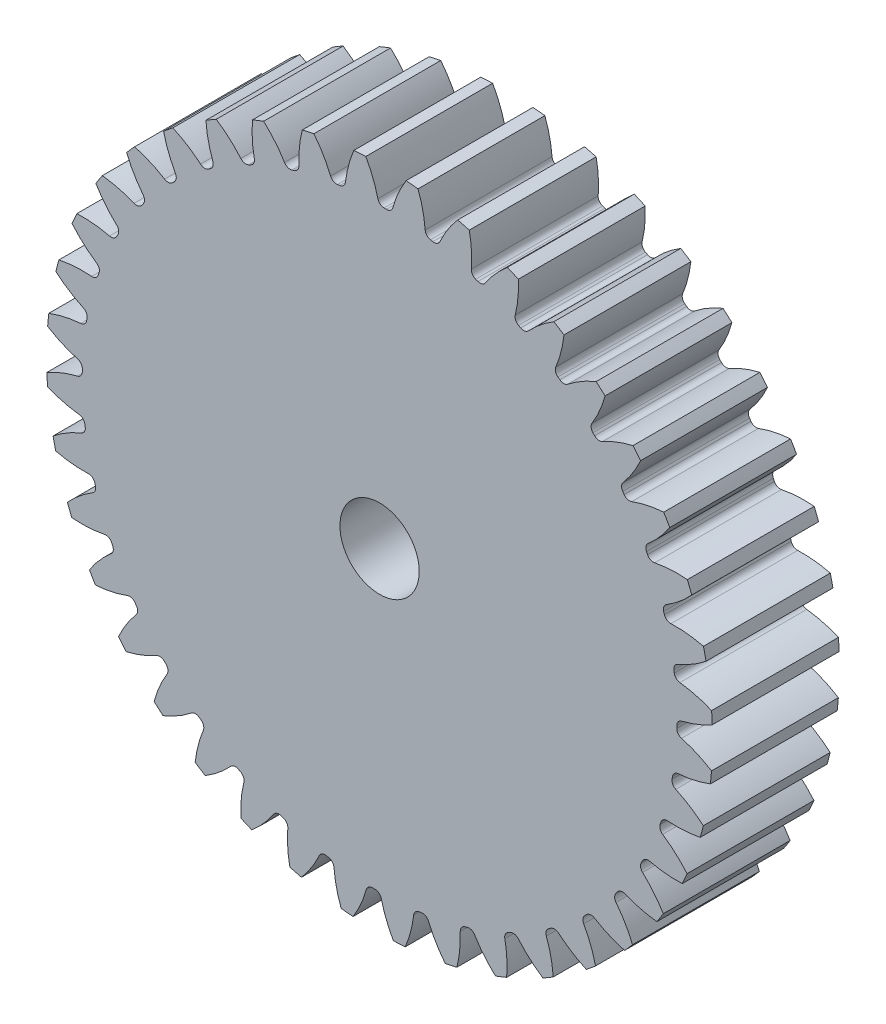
SolidWorks part; units mm, degrees
ref_plane "Front" through (0, 0, 0) normal (0, 0, 1) x (1, 0, 0)
ref_plane "Top" through (0, 0, 0) normal (0, 1, 0) x (1, 0, 0)
ref_plane "Right" through (0, 0, 0) normal (1, 0, 0) x (0, 0, -1)
sketch "Sketch3" plane through (0, 0, 0) normal (0, 0, 1) x (1, 0, 0)
  circle A0 centre (0, 0) radius 266.7
  dimension "od" = 533.4
extrude "gearBody" add sketch "Sketch3" along normal blind 101.6
sketch "Sketch2" plane through (0, 0, 0) normal (0, 0, 1) x (1, 0, 0)
  line L0 (0, 0) -> (220.5133, 91.3396) construction
  line L1 (266.0763, -21.3793) -> (0, 0) construction
  line L2 (0, 0) -> (36.3143, 0) construction
  line L3 (253.9494, 5.0717) -> (253.5687, -14.7955) construction
  line L5 (253.759, -4.8619) -> (0, 0) construction
  line L7 (0, 0) -> (238.6819, 0) construction
  arc A0 (238.6811, 0.62) -> (238.4822, -9.7622) centre (0, 0) ccw construction
  arc A1 (266.4714, 11.0403) -> (265.8529, -21.2393) centre (0, 0) ccw construction
  arc A2 (253.9494, 5.0717) -> (253.5687, -14.7955) centre (0, 0) ccw construction
  arc A3 (238.0606, -5.5372) -> (238.098, -3.5857) centre (0, 0) ccw
  arc A4 (266.0763, -21.3793) -> (241.8326, -10.6343) centre (216.8528, -99.7193) ccw
  arc A5 (266.0763, -21.3793) -> (266.7, 11.1716) centre (0, 0) ccw
  arc A6 (266.7, 11.1716) -> (242.0624, 1.3632) centre (220.5133, 91.3396) cw
  arc A7 (238.098, -3.5857) -> (242.0624, 1.3632) centre (243.2663, -3.6635) cw
  arc A8 (241.8326, -10.6343) -> (238.0606, -5.5372) centre (243.2281, -5.6574) cw
  point P6 (266.7, 11.1716)
  point P22 (266.0763, -21.3793)
  dimension "baseDia" = 477.3639
  dimension "od" = 533.4
  dimension "pd" = 508
  dimension "rd" = 476.25
  dimension "rFillet" = 5.1689
  dimension "pointX" = 266.7
  dimension "pointY" = 11.1716
  dimension "CTT" = 19.8672
  dimension "flankCenterAngle" = 22.5
extrude "toothCut" cut sketch "Sketch2" along normal through all
pattern_circular "CirPattern1" count 40 over 360 about axis through (0, 0, 0) along (0, 0, 1) of "toothCut"
sketch "hub1Dia" plane through (0, 0, 0) normal (0, 0, -1) x (-1, 0, 0)
  circle A0 centre (0, 0) radius 12.7
  dimension "hub1Dia" = 25.4
sketch "hub2Dia" plane through (0, 0, 101.6) normal (0, 0, 1) x (1, 0, 0)
  circle A0 centre (0, 0) radius 12.7
  dimension "hub2dia" = 25.4
sketch "boreDia" plane through (0, 0, 0) normal (0, 0, 1) x (1, 0, 0)
  circle A0 centre (0, 0) radius 31.75
  dimension "boreDia" = 63.5
extrude "bore" cut sketch "boreDia" against normal mid plane 25400
